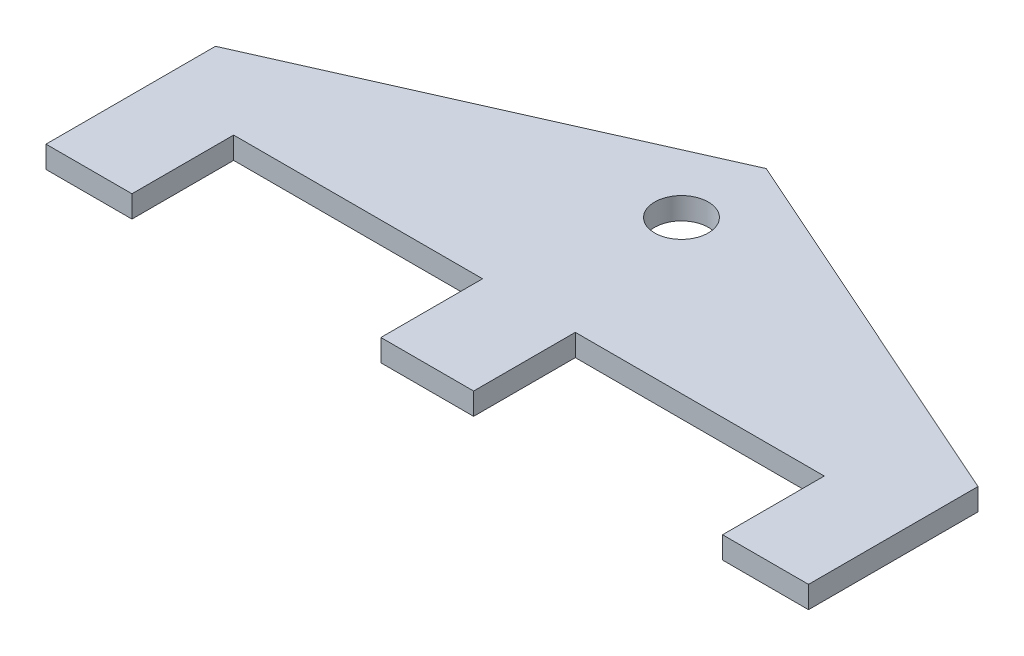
SolidWorks part; units mm, degrees
ref_plane "Front Plane" through (0, 0, 0) normal (0, 0, 1) x (1, 0, 0)
ref_plane "Top Plane" through (0, 0, 0) normal (0, 1, 0) x (1, 0, 0)
ref_plane "Right Plane" through (0, 0, 0) normal (1, 0, 0) x (0, 0, -1)
sketch "Sketch1" plane through (0, 0, 0) normal (0, 1, 0) x (1, 0, 0)
  line L0 (0, 0) -> (0, 31.3394) construction
  line L1 (-35.7124, -23.8125) -> (35.7124, -23.8125)
  line L2 (-35.7124, -23.8125) -> (-35.7124, -7.9375)
  line L3 (-35.7124, -7.9375) -> (0, 7.9375)
  line L4 (35.7124, -23.8125) -> (35.7124, -7.9375)
  line L5 (35.7124, -7.9375) -> (0, 7.9375)
  circle A0 centre (0, 0) radius 2.5146
  dimension "D1" = 5.0292
  dimension "D3" = 7.9375
  dimension "D2" = 71.4248
  dimension "D4" = 31.75
  dimension "D5" = 15.875
extrude "Boss-Extrude1" add sketch "Sketch1" along normal blind 2.0574
sketch "Sketch2" plane through (0, 2.0574, 0) normal (0, 1, 0) x (1, 0, 0)
  line L0 (0, 0) -> (0, -39.8211) construction
  line L1 (-35.7124, -23.8125) -> (35.7124, -23.8125) construction
  line L2 (-27.6606, -23.8125) -> (-4.3434, -23.8125)
  line L3 (-27.6606, -23.8125) -> (-27.6606, -14.2875)
  line L4 (-27.6606, -14.2875) -> (-4.3434, -14.2875)
  line L5 (-4.3434, -23.8125) -> (-4.3434, -14.2875)
  line L6 (27.6606, -14.2875) -> (4.3434, -14.2875)
  line L7 (4.3434, -23.8125) -> (4.3434, -14.2875)
  line L8 (27.6606, -23.8125) -> (4.3434, -23.8125)
  line L9 (27.6606, -23.8125) -> (27.6606, -14.2875)
  dimension "D1" = 23.3172
  dimension "D2" = 8.6868
  dimension "D3" = 9.525
extrude "Cut-Extrude1" cut sketch "Sketch2" against normal blind 2.0574
